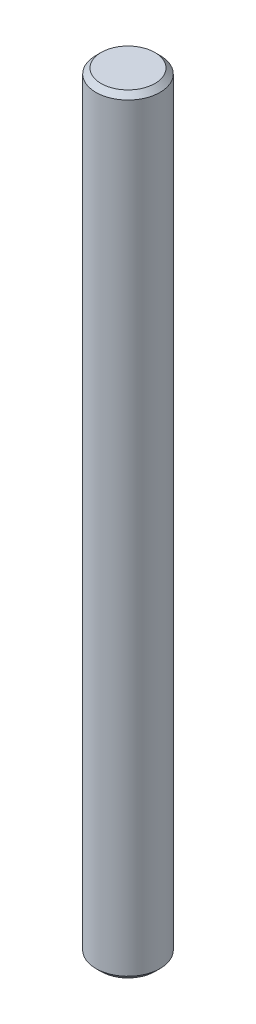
SolidWorks part; units mm, degrees
ref_plane "Front" through (0, 0, 0) normal (0, 0, 1) x (1, 0, 0)
ref_plane "Top" through (0, 0, 0) normal (0, 1, 0) x (1, 0, 0)
ref_plane "Right" through (0, 0, 0) normal (1, 0, 0) x (0, 0, -1)
sketch "Sketch1" plane through (0, 0, 0) normal (0, 1, 0) x (1, 0, 0)
  circle A0 centre (0, 0) radius 2.5
extrude "Extrude1" add sketch "Sketch1" along normal blind 60
chamfer "Chamfer1" distance 0.4 angle 45 2 edges at (0, 0, 2.5) (0, 60, 2.5)
